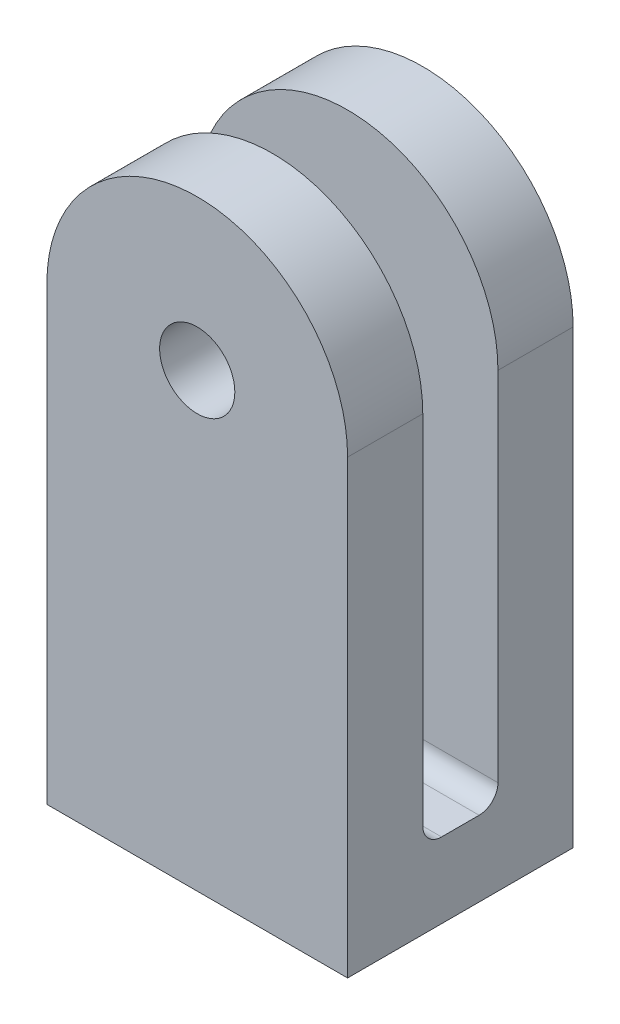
SolidWorks part; units mm, degrees
ref_plane "Front Plane" through (0, 0, 0) normal (0, 0, 1) x (1, 0, 0)
ref_plane "Top Plane" through (0, 0, 0) normal (0, 1, 0) x (1, 0, 0)
ref_plane "Right Plane" through (0, 0, 0) normal (1, 0, 0) x (0, 0, -1)
sketch "Sketch1" plane through (0, 0, 0) normal (0, 0, 1) x (1, 0, 0)
  line L1 (-25.4, 0) -> (25.4, 0)
  line L2 (-25.4, 0) -> (-25.4, 76.2)
  line L3 (-25.4, 76.2) -> (25.4, 76.2) construction
  line L4 (25.4, 0) -> (25.4, 76.2)
  arc A0 (-25.4, 76.2) -> (25.4, 76.2) centre (0, 76.2) cw
  dimension "D1" = 50.8
  dimension "D2" = 76.2
extrude "Extrude1" add sketch "Sketch1" along normal mid plane 38.1
sketch "Sketch2" plane through (25.4, 0, 0) normal (1, 0, 0) x (0, 0, -1)
  line L0 (19.05, 101.6) -> (-19.05, 101.6) construction
  line L1 (-6.35, 101.6) -> (6.35, 101.6)
  line L2 (-6.35, 101.6) -> (-6.35, 15.875)
  line L3 (-3.175, 12.7) -> (3.175, 12.7)
  line L4 (6.35, 101.6) -> (6.35, 15.875)
  line L5 (0, 12.7) -> (0, 0) construction
  line L6 (-19.05, 0) -> (19.05, 0) construction
  arc A0 (-6.35, 15.875) -> (-3.175, 12.7) centre (-3.175, 15.875) ccw
  arc A1 (3.175, 12.7) -> (6.35, 15.875) centre (3.175, 15.875) ccw
  dimension "D3" = 3.175
  dimension "D1" = 12.7
  dimension "D2" = 12.7
extrude "Cut-Extrude3" cut sketch "Sketch2" against normal through all
sketch "Sketch3" plane through (0, 0, 19.05) normal (0, 0, 1) x (1, 0, 0)
  circle A0 centre (0, 76.2) radius 6.35
  dimension "D1" = 12.7
extrude "Cut-Extrude4" cut sketch "Sketch3" against normal through all
